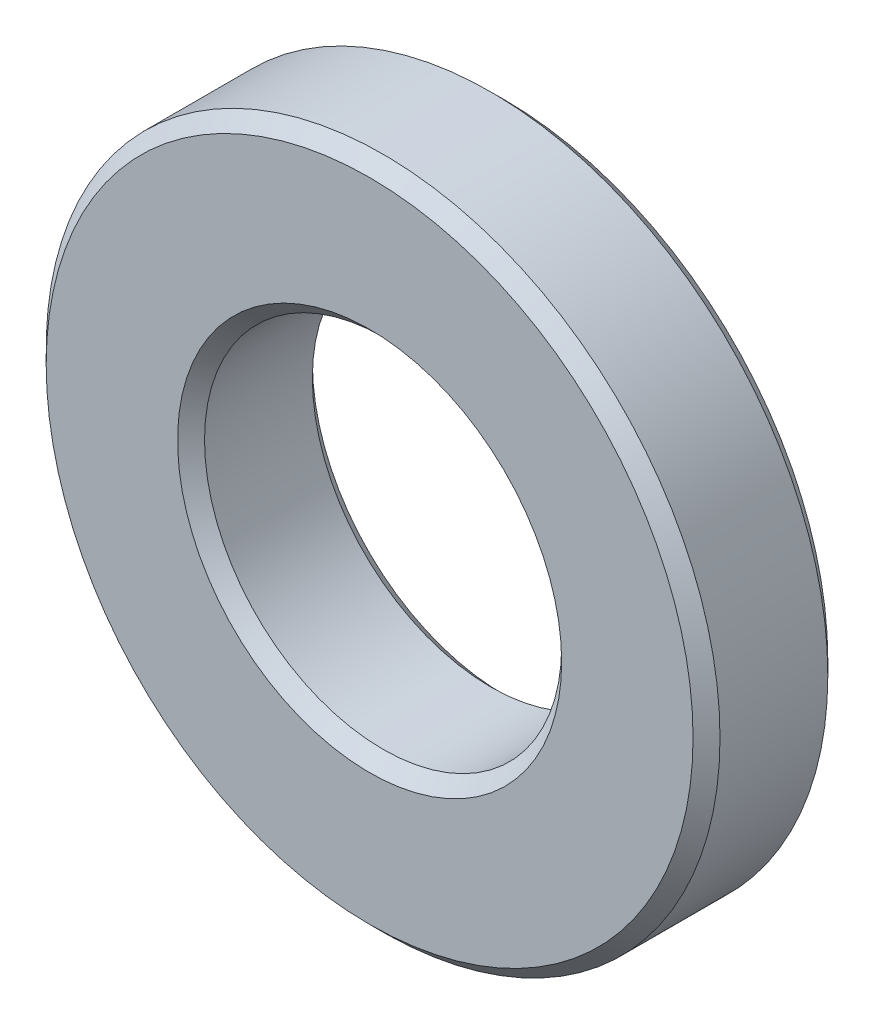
SolidWorks part; units mm, degrees
ref_plane "Front Plane" through (0, 0, 0) normal (0, 0, 1) x (1, 0, 0)
ref_plane "Top Plane" through (0, 0, 0) normal (0, 1, 0) x (1, 0, 0)
ref_plane "Right Plane" through (0, 0, 0) normal (1, 0, 0) x (0, 0, -1)
sketch "Sketch1" plane through (0, 0, 0) normal (0, 0, 1) x (1, 0, 0)
  circle A0 centre (0, 0) radius 5
  circle A1 centre (0, 0) radius 2.65
  dimension "D1" = 10
  dimension "D2" = 5.3
extrude "Boss-Extrude2" add sketch "Sketch1" along normal mid plane 2
chamfer "Chamfer3" distance 0.2 angle 45 4 edges at (5, 0, 1) (5, 0, -1) (2.65, 0, -1) (2.65, 0, 1)
